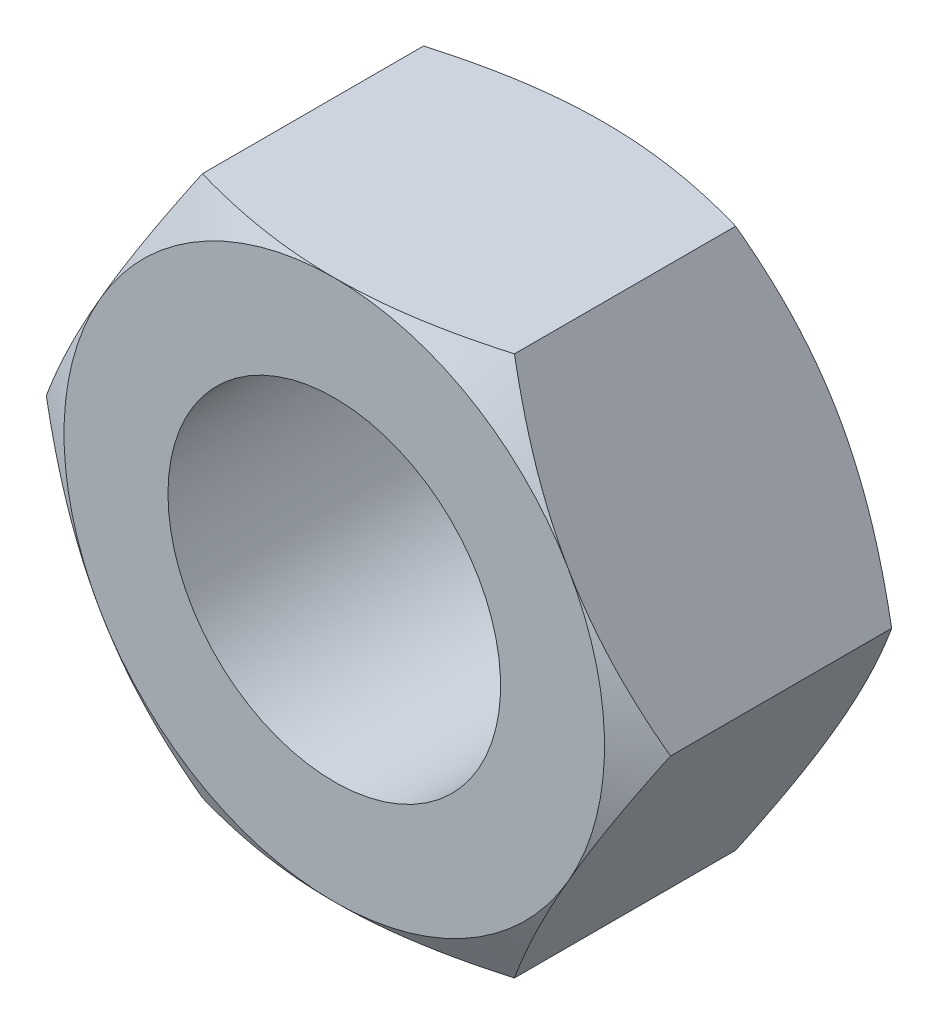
SolidWorks part; units mm, degrees
ref_plane "Plan1" through (0, 0, 0) normal (0, 0, 1) x (1, 0, 0)
ref_plane "Plan2" through (0, 0, 0) normal (0, 1, 0) x (1, 0, 0)
ref_plane "Plan3" through (0, 0, 0) normal (1, 0, 0) x (0, 0, -1)
sketch "Esquisse1" plane through (0, 0, 0) normal (0, 0, 1) x (1, 0, 0)
  line L0 (-3.7528, -6.5) -> (-7.5056, 0)
  line L1 (3.7528, -6.5) -> (-3.7528, -6.5)
  line L2 (7.5056, 0) -> (3.7528, -6.5)
  line L3 (-7.5056, 0) -> (-3.7528, 6.5)
  line L4 (-3.7528, 6.5) -> (3.7528, 6.5)
  line L5 (3.7528, 6.5) -> (7.5056, 0)
  circle A0 centre (0, 0) radius 4
  dimension "D6" = 8
  dimension "D1" = 6.5
  dimension "D2" = 6.5
  dimension "D3" = 6.5
  dimension "D4" = 6.5
  dimension "D5" = 6.5
extrude "Base-Extrusion" add sketch "Esquisse1" along normal blind 6.5
sketch "Esquisse2" plane through (0, 0, 0) normal (0, 0, -1) x (-1, 0, 0)
  circle A0 centre (0, 0) radius 8.952
  circle A1 centre (0, 0) radius 6.467
extrude "Enlèv. mat.-Extru.1" cut sketch "Esquisse2" against normal blind 5 draft 60
sketch "Esquisse3" plane through (0, 0, 6.5) normal (0, 0, 1) x (1, 0, 0)
  circle A0 centre (0, 0) radius 6.5
  circle A1 centre (0, 0) radius 9.1193
extrude "Enlèv. mat.-Extru.2" cut sketch "Esquisse3" against normal blind 5 draft 60
